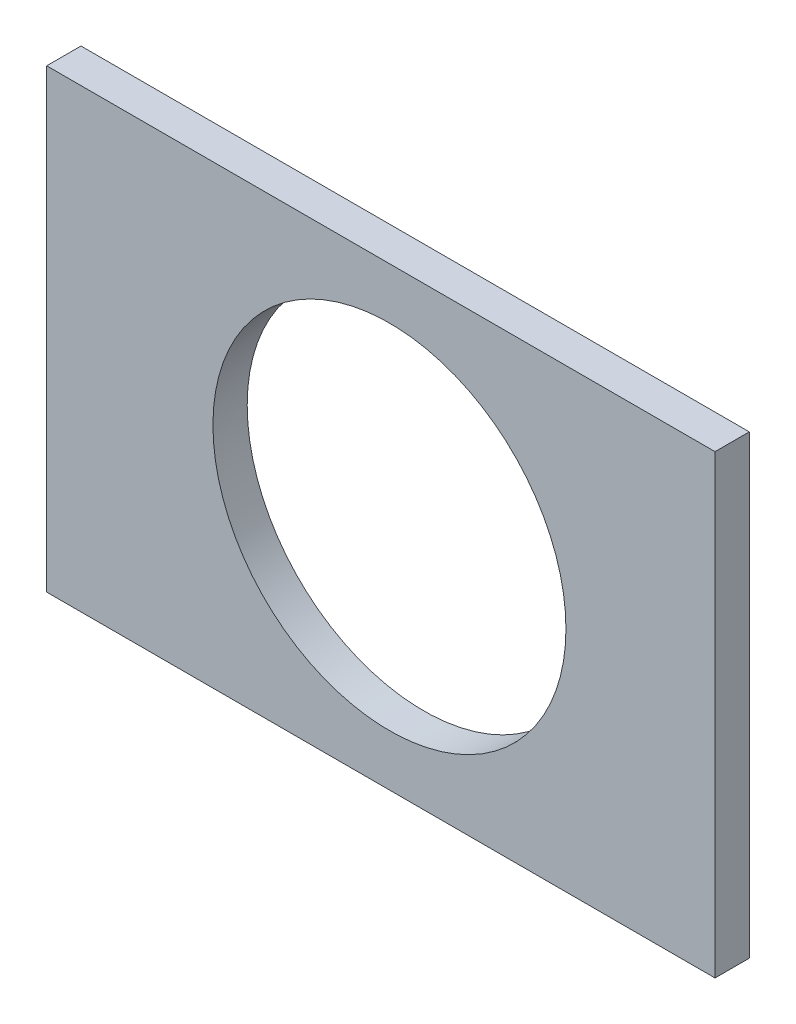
SolidWorks part; units mm, degrees
ref_plane "Plan de face" through (0, 0, 0) normal (0, 0, 1) x (1, 0, 0)
ref_plane "Plan de dessus" through (0, 0, 0) normal (0, 1, 0) x (1, 0, 0)
ref_plane "Plan de droite" through (0, 0, 0) normal (1, 0, 0) x (0, 0, -1)
sketch "Esquisse1" plane through (0, 0, 0) normal (0, 0, 1) x (1, 0, 0)
  line L1 (0, 0) -> (195, 0)
  line L2 (0, 0) -> (0, 133)
  line L3 (0, 133) -> (195, 133)
  line L4 (195, 0) -> (195, 133)
  dimension "D1" = 195
  dimension "D2" = 133
extrude "Extrusion1" add sketch "Esquisse1" along normal blind 10
sketch "Esquisse2" plane through (0, 0, 10) normal (0, 0, 1) x (1, 0, 0)
  line L0 (0, 0) -> (195, 0) construction
  line L1 (0, 133) -> (0, 0) construction
  circle A0 centre (100, 66.5) radius 51.5
  dimension "D2" = 100
  dimension "D3" = 103
  dimension "D1" = 66.5
extrude "Enlèv. mat.-Extru.1" cut sketch "Esquisse2" against normal up to next
